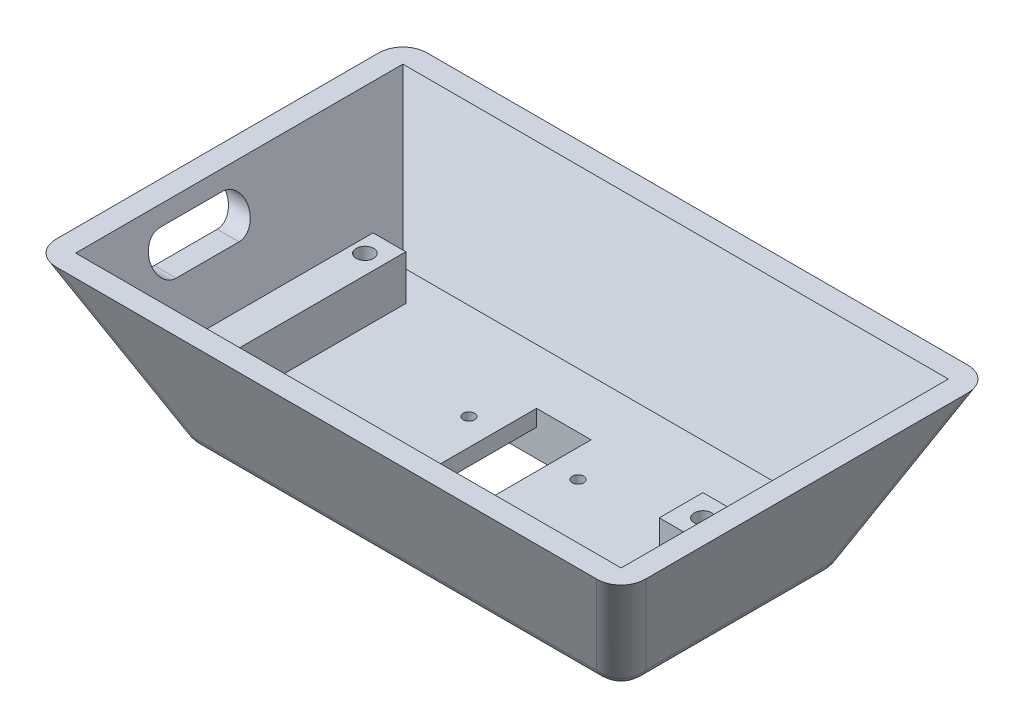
SolidWorks part; units mm, degrees
ref_plane "Front Plane" through (0, 0, 0) normal (0, 0, 1) x (1, 0, 0)
ref_plane "Top Plane" through (0, 0, 0) normal (0, 1, 0) x (1, 0, 0)
ref_plane "Right Plane" through (0, 0, 0) normal (1, 0, 0) x (0, 0, -1)
sketch "Sketch1" plane through (0, 0, 0) normal (0, 1, 0) x (1, 0, 0)
  line L1 (-40, 20) -> (40, 20)
  line L2 (-40, 20) -> (-40, -20)
  line L3 (-40, -20) -> (40, -20)
  line L4 (40, 20) -> (40, -20)
  line L5 (-40, 20) -> (40, -20) construction
  line L6 (-40, -20) -> (40, 20) construction
  point P0 (0, 0)
  dimension "D1" = 40
  dimension "D2" = 80
extrude "Base Extrusion" add sketch "Sketch1" along normal blind 30 draft 25
sketch "Sketch2" plane through (0, 0, 0) normal (0, -1, 0) x (1, 0, 0)
  line L0 (0, 9.6) -> (0, 20) construction
  line L1 (-15.1, 9.6) -> (15.1, 9.6)
  line L2 (-15.1, 9.6) -> (-15.1, -9.6)
  line L3 (-15.1, -9.6) -> (15.1, -9.6)
  line L4 (15.1, 9.6) -> (15.1, -9.6)
  line L5 (-15.1, 9.6) -> (15.1, -9.6) construction
  line L6 (-15.1, -9.6) -> (15.1, 9.6) construction
  line L7 (-40, 20) -> (40, 20) construction
  point P0 (0, 0)
  dimension "D1" = 19.2
  dimension "D2" = 30.2
  dimension "D3" = 10.4
extrude "Triangle Attach Cutout" cut sketch "Sketch2" against normal blind 5
sketch "Sketch3" plane through (0, 30, 0) normal (0, 1, 0) x (1, 0, 0)
  line L17 (-49.9892, 29.9892) -> (-49.9892, -29.9892)
  line L18 (-49.9892, -29.9892) -> (49.9892, -29.9892)
  line L19 (49.9892, -29.9892) -> (49.9892, 29.9892)
  line L20 (49.9892, 29.9892) -> (-49.9892, 29.9892)
  line L21 (-49.9892, 29.9892) -> (-49.9892, -29.9892)
  line L22 (-49.9892, -29.9892) -> (49.9892, -29.9892)
  line L23 (49.9892, -29.9892) -> (49.9892, 29.9892)
  line L24 (49.9892, 29.9892) -> (-49.9892, 29.9892)
  dimension "D2" = 4
extrude "Shell out the base" cut sketch "Sketch3" against normal blind 22 draft 25
sketch "Sketch5" plane through (0, 5, 0) normal (0, -1, 0) x (1, 0, 0)
  line L0 (0, -2.1) -> (-10, -2.1) construction
  line L1 (0, -1000) -> (0, 49000) construction
  line L2 (-5.1, 5.6) -> (-5.1, 9.6) construction
  line L3 (15.1, 9.6) -> (-15.1, 9.6) construction
  line L4 (-5.1, 9.6) -> (4.9, 9.6) construction
  line L6 (4.9, 9.6) -> (-5.1, 9.6)
  line L7 (4.9, 9.6) -> (4.9, -9.6)
  line L8 (4.9, -9.6) -> (-5.1, -9.6)
  line L9 (-5.1, 9.6) -> (-5.1, -9.6)
  line L11 (-15.1, -9.6) -> (15.1, -9.6) construction
  circle A0 centre (-10, -2.1) radius 1.05
  circle A2 centre (10, -2.1) radius 1.05
  dimension "D3" = 2.1
  dimension "D1" = 10
  dimension "D2" = 2.1
  dimension "D5" = 4
  dimension "D6" = 10
extrude "LED Strip Cutout" cut sketch "Sketch5" against normal up to next
sketch "Sketch13" plane through (0, 0, 0) normal (0, 1, 0) x (1, 0, 0)
  line L0 (-39.7305, -19.7305) -> (39.7305, -19.7305) construction
  line L1 (-39.7305, -19.7305) -> (-33.7305, -19.7305)
  line L2 (-39.7305, -19.7305) -> (-39.7305, 14.2695)
  line L3 (-39.7305, 14.2695) -> (-33.7305, 14.2695)
  line L4 (-33.7305, -19.7305) -> (-33.7305, 14.2695)
  line L5 (31.7305, -4.7305) -> (39.7305, -4.7305)
  line L6 (31.7305, -4.7305) -> (31.7305, 3.2695)
  line L7 (31.7305, 3.2695) -> (39.7305, 3.2695)
  line L8 (39.7305, -4.7305) -> (39.7305, 3.2695)
  line L9 (39.7305, -19.7305) -> (39.7305, 19.7305) construction
  line L10 (31.7305, -0.7305) -> (39.7305, -0.7305) construction
  line L11 (-39.7305, 19.7305) -> (-39.7305, -19.7305) construction
  circle A0 centre (35.7305, -0.7305) radius 1.6002
  circle A1 centre (-37.2305, 10.2695) radius 1.6002
  dimension "D7" = 3.2004
  dimension "D1" = 34
  dimension "D2" = 6
  dimension "D3" = 15
  dimension "D4" = 8
  dimension "D5" = 8
  dimension "D8" = 2.5
  dimension "D9" = 30
extrude "PCB Ledge" add sketch "Sketch13" along normal blind 8.2 from surface at 8
sketch "Sketch14" plane through (0, 0, 0) normal (1, 0, 0) x (0, 0, -1)
  line L0 (-15.75, 24.25) -> (-4.25, 24.25) construction
  line L1 (-15.75, 27.5) -> (-4.25, 27.5)
  line L2 (-15.75, 21) -> (-4.25, 21)
  arc A0 (-15.75, 27.5) -> (-15.75, 21) centre (-15.75, 24.25) ccw
  arc A1 (-4.25, 21) -> (-4.25, 27.5) centre (-4.25, 24.25) ccw
  point P2 (-10, 24.25)
  dimension "D1" = 24.25
  dimension "D4" = 11.5
  dimension "D2" = 10
  dimension "D3" = 6.5
extrude "USB-C Cutout" cut sketch "Sketch14" against normal up to next
fillet "Fillet1" radius 5 8 edges at (-40, 0, 0) (0, 0, 20) (40, 0, 0) (0, 0, -20) (-46.9946, 15, 26.9946) (46.9946, 15, 26.9946) (46.9946, 15, -26.9946) (-46.9946, 15, -26.9946)
